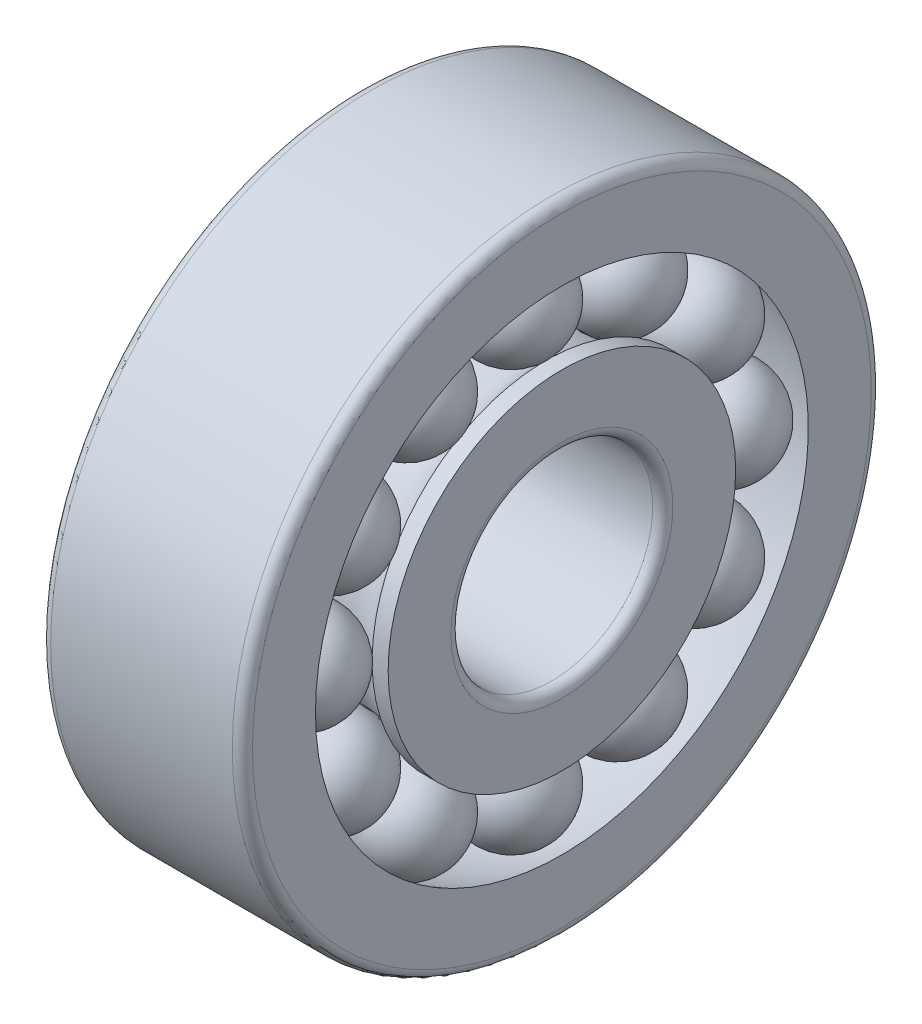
SolidWorks part; units mm, degrees
ref_plane "Front" through (0, 0, 0) normal (0, 0, 1) x (1, 0, 0)
ref_plane "Top" through (0, 0, 0) normal (0, 1, 0) x (1, 0, 0)
ref_plane "Right" through (0, 0, 0) normal (1, 0, 0) x (0, 0, -1)
sketch "Sketch1" plane through (0, 0, 0) normal (0, 0, 1) x (1, 0, 0)
  line L0 (0, 0) -> (10.4156, 0) construction
  line L1 (-3, 3) -> (3, 3)
  line L2 (3, 3) -> (3, 5.1667)
  line L3 (3, 5.1667) -> (2.523, 5.1667)
  line L4 (-3, 5.1667) -> (-3, 3)
  line L5 (-2.523, 5.1667) -> (-3, 5.1667)
  line L6 (0.477, 5.1667) -> (-0.477, 5.1667)
  circle A0 centre (-1.5, 6.25) radius 1.49 construction
  circle A1 centre (1.5, 6.25) radius 1.49 construction
  arc A2 (-2.523, 5.1667) -> (-0.477, 5.1667) centre (-1.5, 6.25) ccw
  arc A3 (0.477, 5.1667) -> (2.523, 5.1667) centre (1.5, 6.25) ccw
  point P8 (0, 3)
  dimension "D1" = 1.5
  dimension "D2" = 1.5
  dimension "QXD" = 2.98
  dimension "XD1" = 10.3333
  dimension "XD" = 6
  dimension "DB" = 6
  dimension "QDD" = 12.5
revolve "Revovle1" add sketch "Sketch1" angle 360 about L0
sketch "Sketch2" plane through (0, 0, 0) normal (0, 0, 1) x (1, 0, 0)
  line L0 (-2.9995, 6.25) -> (-0.0005, 6.25)
  line L1 (-4.0336, 6.25) -> (6.5093, 6.25) construction
  arc A2 (-2.9995, 6.25) -> (-0.0005, 6.25) centre (-1.5, 6.25) ccw
  dimension "D1" = 6.25
  dimension "QXD" = 2.999
  dimension "D2" = 1.5
revolve "Revolve2" add sketch "Sketch2" angle 360 about L1
mirror "Mirror1" about plane through (0, 0, 0) normal (1, 0, 0) of "Revolve2"
sketch "Sketch3" plane through (0, 0, 0) normal (0, 0, 1) x (1, 0, 0)
  line L0 (-3, 7.3271) -> (-3, 9.5)
  line L1 (-3, 9.5) -> (3, 9.5)
  line L2 (3, 9.5) -> (3, 7.3271)
  line L5 (0, 0) -> (7.3928, 0) construction
  line L7 (3, -5.1667) -> (3, 5.1667) construction
  line L8 (-3, 5.1667) -> (-3, -5.1667) construction
  circle A0 centre (-1.5, 6.25) radius 1.49 construction
  circle A1 centre (1.5, 6.25) radius 1.49 construction
  arc A2 (3, 7.3271) -> (-3, 7.3271) centre (0, 0) ccw
  dimension "D2" = 2.98
  dimension "D1" = 6.25
  dimension "D3" = 1.5
  dimension "D4" = 1.5
  dimension "DD" = 19
revolve "Revolve3" add sketch "Sketch3" angle 360 about L5
pattern_circular "Circular-Pattern1" count 12 over 360 about axis through (0, 0, 0) along (1, 0, 0) of "Revolve2", "Mirror1"
fillet "Fillet1" radius 0.3 4 edges at (-3, 0, 3) (-3, 0, 9.5) (3, 0, 3) (3, 0, 9.5)
equation "\"XD1@Sketch1\" = \"XD@Sketch1\" +  ( \"DD@Sketch3\" - \"XD@Sketch1\" )  / 3"
equation "\"QDD@Sketch1\" = \"XD@Sketch1\" +  ( \"DD@Sketch3\" - \"XD@Sketch1\" )  / 2"
equation "\"QXD@Sketch1\" = \"DB@Sketch1\" / 2 - 0.02"
equation "\"D1@Sketch1\" = \"DB@Sketch1\" / 4"
equation "\"D2@Sketch1\" = \"D1@Sketch1\""
equation "\"QXD@Sketch2\" = \"DB@Sketch1\"/2-0.001"
equation "\"D2@Sketch2\" = \"D2@Sketch1\""
equation "\"D1@Sketch2\" = \"QDD@Sketch1\" / 2"
equation "\"D1@Sketch3\" = \"QDD@Sketch1\" / 2"
equation "\"D2@Sketch3\" = \"QXD@Sketch1\""
equation "\"D3@Sketch3\" = \"D2@Sketch1\""
equation "\"D4@Sketch3\" = \"D3@Sketch3\""
equation "\"D1@Circular-Pattern1\" = int( 3.14159265 / atn(( \"QXD@Sketch2\" / 2) / sqr(\"QDD@Sketch1\" *\"QDD@Sketch1\"/4 - ( \"QXD@Sketch2\" / 2) *  ( \"QXD@Sketch2\" / 2))))"
